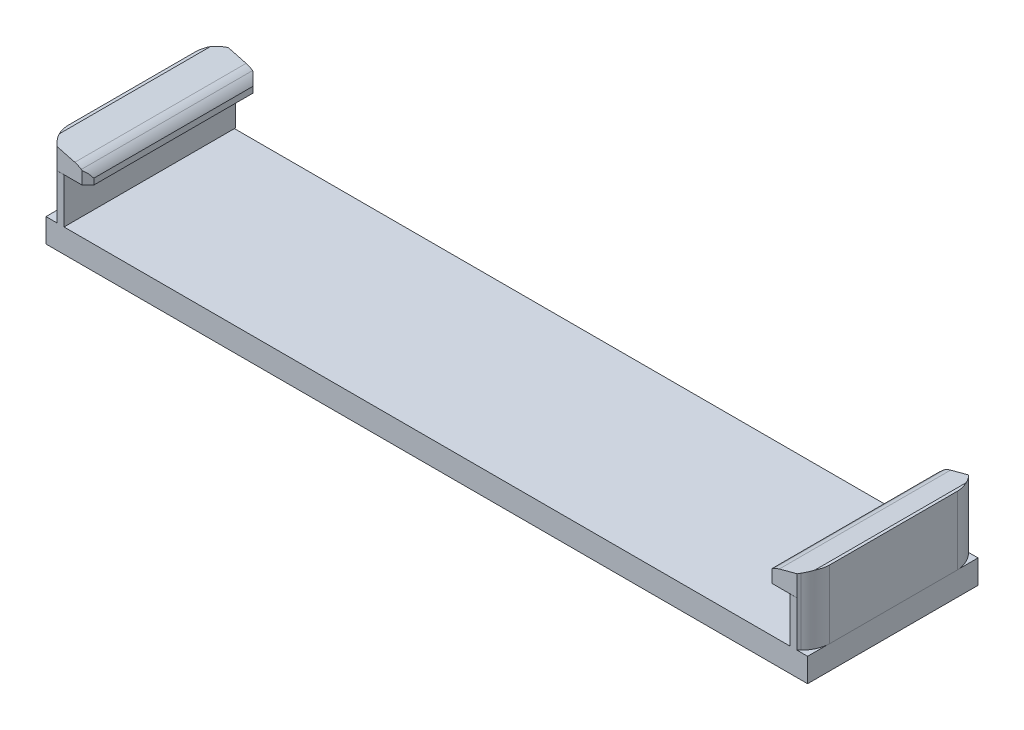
SolidWorks part; units mm, degrees
ref_plane "前视基准面" through (0, 0, 0) normal (0, 0, 1) x (1, 0, 0)
ref_plane "上视基准面" through (0, 0, 0) normal (0, 1, 0) x (1, 0, 0)
ref_plane "右视基准面" through (0, 0, 0) normal (1, 0, 0) x (0, 0, -1)
other "Configuration Table"
imported_body "曲面-输入1"
sketch "草图1" plane through (0, 0, 0) normal (0, 1, 0) x (1, 0, 0)
  line L1 (31.9846, -14.3931) -> (-32.0154, -14.3931)
  line L2 (31.9846, -14.3931) -> (31.9846, 0)
  line L3 (31.9846, 0) -> (-32.0154, 0)
  line L4 (-32.0154, -14.3931) -> (-32.0154, 0)
  dimension "D1" = 64
extrude "凸台-拉伸1" add sketch "草图1" along normal blind 3
sketch "草图2" plane through (0, 3, 0) normal (0, 1, 0) x (1, 0, 0)
  line L1 (-30.5, -14.4) -> (-31.9968, -14.4)
  line L2 (-30.5, -14.4) -> (-30.5, 0)
  line L3 (-30.5, 0) -> (-31.9968, 0)
  line L4 (-31.9968, -14.4) -> (-31.9968, 0)
extrude "凸台-拉伸2" add sketch "草图2" along normal blind 3.8
sketch "草图4" plane through (0, 0, 0) normal (0, 0, -1) x (-1, 0, 0)
  line L0 (31.7468, 6.8) -> (28.5, 6.8)
  line L1 (28.5, 6.8) -> (28.5, 7.3)
  line L2 (29.6, 8.1569) -> (31.7468, 8.7322)
  line L7 (31.7468, 6.8) -> (31.9968, 6.8)
  line L8 (31.9968, 6.8) -> (31.9968, 8.7322)
  line L9 (31.9968, 8.7322) -> (31.7468, 8.7322)
  arc A0 (28.5, 7.3) -> (29.0545, 7.9066) centre (30.0634, 6.4276) cw
  arc A1 (29.0545, 7.9066) -> (29.6, 8.1569) centre (30.0633, 6.4277) cw
extrude "凸台-拉伸3" add sketch "草图4" against normal up to surface (14.3931 mm away)
sketch "草图7" plane through (0, 3, 0) normal (0, 1, 0) x (1, 0, 0)
  line L0 (-31.2678, -0.1678) -> (-31.1, 0)
  line L1 (-31.1, 0) -> (-32, 0)
  line L7 (-29, 0) -> (-28.3748, -0.6252)
  line L8 (-29, 0) -> (-28.3748, 0)
  line L9 (-32, -1.9355) -> (-32, 0)
  line L10 (-28.3748, -0.6252) -> (-28.3748, 0)
  line L11 (-29, -14.4) -> (-28.3693, -14.4)
  line L12 (-28.3693, -14.4) -> (-28.3693, -13.7693)
  line L13 (-28.3693, -13.7693) -> (-29, -14.4)
  line L14 (-31.2678, -14.2322) -> (-31.1, -14.4)
  line L15 (-31.1, -14.4) -> (-32, -14.4)
  line L21 (-32, -12.4645) -> (-32, -14.4)
  arc A0 (-32, -1.9355) -> (-31.2678, -0.1678) centre (-29.5, -1.9355) cw
  arc A1 (-32, -12.4645) -> (-31.2678, -14.2322) centre (-29.5, -12.4645) ccw
extrude "切除-拉伸3" cut sketch "草图7" along normal through all
mirror "镜向1" about plane through (0, 0, 0) normal (1, 0, 0) of "切除-拉伸3", "凸台-拉伸3", "凸台-拉伸2"
sketch "草图8" plane through (0, 0, 0) normal (0, -1, 0) x (-1, 0, 0)
  line L0 (32.0154, 0) -> (32.0154, -14.3931) construction
  line L1 (32.0154, -15.3931) -> (-31.9846, -15.3931)
  line L2 (32.0154, -15.3931) -> (32.0154, 24.8035)
  line L3 (32.0154, 24.8035) -> (-31.9846, 24.8035) construction
  line L4 (-31.9846, -15.3931) -> (-31.9846, 24.8035)
  line L5 (-31.9846, -14.3931) -> (-31.9846, 0) construction
  line L6 (32.0154, -14.3931) -> (-31.9846, -14.3931) construction
  line L7 (-31.9846, -14.3931) -> (-31.9846, 0) construction
  line L8 (32.0154, 24.8035) -> (17.3676, 24.8035)
  line L12 (-17.3676, 24.8035) -> (-31.9846, 24.8035)
  line L13 (17.3676, 24.8035) -> (0, 0)
  line L14 (0, 0) -> (-17.3676, 24.8035)
  point P12 (-31.9846, -7.1965)
  dimension "D1" = 1
  dimension "D2" = 32
  dimension "D3" = 125
  dimension "D4" = 125
extrude "凸台-拉伸4" add sketch "草图8" against normal up to surface (3 mm away)
other "移动面1" parameters "D1"=1
sketch "草图15" plane through (0, 3, 0) normal (0, 1, 0) x (1, 0, 0)
  line L1 (-36.6439, 25.1372) -> (37.5223, 25.1372)
  line L2 (-36.6439, 25.1372) -> (-36.6439, -0.0803)
  line L3 (-36.6439, -0.0803) -> (37.5223, -0.0803)
  line L4 (37.5223, 25.1372) -> (37.5223, -0.0803)
extrude "切除-拉伸6" cut sketch "草图15" against normal blind 20
sketch "草图16" plane through (0, 3, 0) normal (0, 1, 0) x (1, 0, 0)
  line L0 (-32.0154, -14.4) -> (31.9846, -14.4)
  line L2 (-32.0154, -15.3931) -> (31.9846, -15.3931)
  line L3 (-32.0154, -15.3931) -> (-32.0154, -14.4)
  line L5 (31.9846, -15.3931) -> (31.9846, -14.4)
extrude "切除-拉伸7" cut sketch "草图16" against normal blind 10
